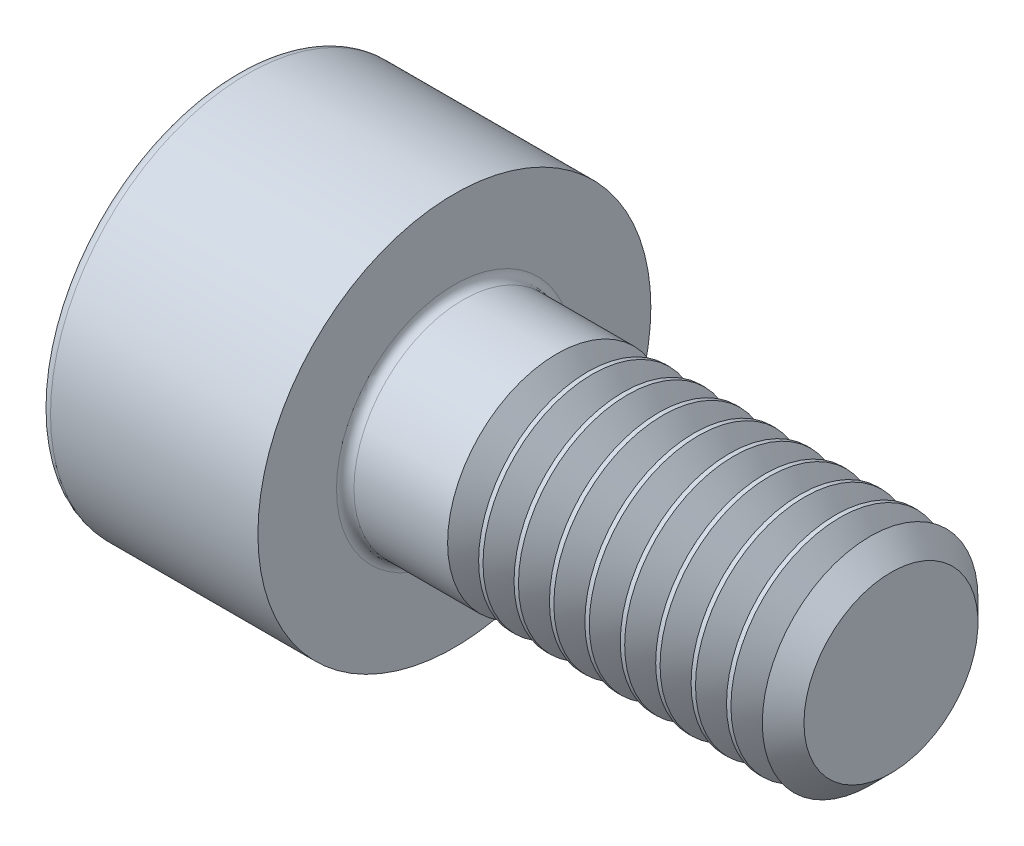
SolidWorks part; units mm, degrees
ref_plane "Plane1" through (0, 0, 0) normal (0, 0, 1) x (1, 0, 0)
ref_plane "Plane2" through (0, 0, 0) normal (0, 1, 0) x (1, 0, 0)
ref_plane "Plane3" through (0, 0, 0) normal (1, 0, 0) x (0, 0, -1)
sketch "BodySke" plane through (0, 0, 0) normal (0, 0, 1) x (1, 0, 0)
  line L0 (0, 0) -> (0, 2.25)
  line L1 (0, 2.25) -> (2.5, 2.25)
  line L2 (2.5, 2.25) -> (2.5, 1.25)
  line L3 (2.5, 1.25) -> (7.2465, 1.25)
  line L4 (7.5, 0.9965) -> (7.5, 0)
  line L5 (7.5, 0) -> (0, 0)
  line L6 (-31.75, 0) -> (127, 0) construction
  line L8 (7.5, 0.9965) -> (7.2465, 1.25)
  line L10 (7.5, -0.9965) -> (7.2465, -1.25) construction
  line L11 (2.95, 0.1695) -> (2.95, -6.1805) construction
  line L12 (3.5, 0.1695) -> (3.5, -6.1805) construction
  line L13 (-52.5, 0.1695) -> (-52.5, -6.1805) construction
  dimension "Diameter" = 2.5
  dimension "Head_ht" = 2.5
  dimension "Length" = 5
  dimension "Body_ch_ang" = 45
  dimension "Head_dia" = 4.5
  dimension "Minor_dia" = 1.993
  dimension "Advance" = 0.45
  dimension "Thread_nom" = 4
  dimension "Thread_length" = 60
revolve "Base-Revolve" add sketch "BodySke"
fillet "Fillet1" radius 0.1 1 edges at (2.5, 0, 1.25)
fillet "Fillet2" radius 0.125 1 edges at (0, 0, 2.25)
sketch "Sketch2" plane through (0, 0, 0) normal (0, 0, 1) x (1, 0, 0)
  line L0 (0, 1.0225) -> (1.1, 1.0225)
  line L1 (1.1, 1.0225) -> (1.6903, 0)
  line L2 (-31.75, 0) -> (127, 0) construction
  line L3 (1.6903, 0) -> (0, 0)
  line L4 (0, 0) -> (0, 1.0225)
  line L6 (0, 0) -> (47.625, 0) construction
  dimension "D1" = 1.0225
  dimension "D2" = 60
  dimension "Depth" = 1.1
revolve "Hex-PreBroach" cut sketch "Sketch2" angle 360 about L6
sketch "Sketch3" plane through (0, 0, 0) normal (-1, 0, 0) x (0, 0.5, 0.866)
  line L0 (0.5903, 1.0225) -> (-0.5903, 1.0225)
  line L1 (-0.5903, 1.0225) -> (-1.1807, 0)
  line L2 (0.5903, 1.0225) -> (1.1807, 0)
  line L3 (0.5903, -1.0225) -> (1.1807, 0)
  line L4 (0.5903, -1.0225) -> (-0.5903, -1.0225)
  line L5 (-0.5903, -1.0225) -> (-1.1807, 0)
  dimension "D1" = 1.0225
  dimension "D2" = 1.0225
  dimension "Hex_size" = 2.045
extrude "Hex" cut sketch "Sketch3" against normal blind 1.1
sketch "ThdSchSke" plane through (0, 0, 0) normal (0, 0, 1) x (1, 0, 0)
  line L0 (3.85, -0.9965) -> (3.6725, -1.25)
  line L1 (3.85, -0.9965) -> (4.0275, -1.25)
  line L2 (4.0275, -1.25) -> (4.0275, -1.5625)
  line L3 (-3.175, 0) -> (5.1513, 0) construction
  line L4 (0, 2.125) -> (0, -2.125) construction
  line L5 (4.0275, -1.5625) -> (3.6725, -1.5625)
  line L6 (3.6725, -1.5625) -> (3.6725, -1.25)
  dimension "Thread_minor" = 1.993
  dimension "Diameter" = 2.5
  dimension "Start" = 3.85
  dimension "SideAngle" = 55
  dimension "VeeAngle" = 70
  dimension "Overcut" = 3.125
revolve "ThreadSchematic" cut sketch "ThdSchSke" angle 360 about L3
pattern_linear "ThdSchPat" count 9 spacing 0.4056 along (1, 0, 0) of "ThreadSchematic"
equation "\"D2@Sketch3\" = \"Hex_size@Sketch3\" / 2"
equation "\"D1@Sketch3\" = \"Hex_size@Sketch3\" / 2"
equation "\"D1@Sketch2\" = \"Hex_size@Sketch3\" / 2"
equation "\"Thread_minor@ThreadCosmetic\"  =  \"Minor_dia@BodySke\""
equation "\"Depth@Sketch2\" =  \"Key_eng@Hex\""
equation "\"Thread_length@ThreadCosmetic\" = ((sgn( (\"Length@BodySke\" - \"Advance@BodySke\" * 3.0) - \"Thread_nom@BodySke\" )-1)*( (\"Length@BodySke\" - \"Advance@BodySke\" * 3.0) - \"Thread_nom@BodySke\" ))/-2+ \"Thread_no"
equation "\"Thread_minor@ThdSchSke\" = \"Minor_dia@BodySke\""
equation "\"Diameter@ThdSchSke\" = \"Diameter@BodySke\""
equation "\"Overcut@ThdSchSke\" = \"Diameter@BodySke\" * 1.25"
equation "\"Start@ThdSchSke\" = \"Head_ht@BodySke\" + \"Length@BodySke\" - \"Thread_length@ThreadCosmetic\"  '---Non-countersunk---"
equation "\"Num_threads@ThdSchPat\" = int( \"Thread_length@ThreadCosmetic\" / \"Advance@BodySke\" + 0.999 )  + 1"
equation "\"Advance@ThdSchPat\" = \"Thread_length@ThreadCosmetic\" /  (\"Num_threads@ThdSchPat\" - 1) 'relax it"
equation "\"Num_threads@ThdSchPat\" = \"Num_threads@ThdSchPat\" - sgn( \"Num_threads@ThdSchPat\" - 1) '---chamfered tips only---"
